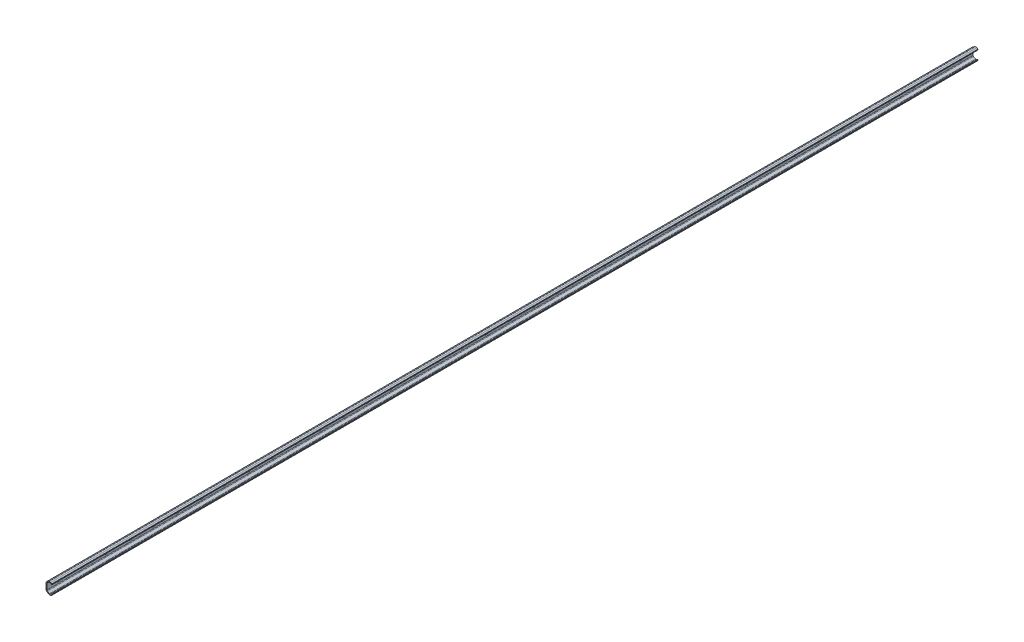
SolidWorks part; units mm, degrees
ref_plane "Front Plane" through (0, 0, 0) normal (0, 0, 1) x (1, 0, 0)
ref_plane "Top Plane" through (0, 0, 0) normal (0, 1, 0) x (1, 0, 0)
ref_plane "Right Plane" through (0, 0, 0) normal (1, 0, 0) x (0, 0, -1)
sketch "Sketch1" plane through (0, 0, 0) normal (0, 0, 1) x (1, 0, 0)
  line L0 (19.4996, 13.4748) -> (20, 14.3415)
  line L1 (20, 14.3415) -> (20, 16.65)
  line L2 (20, 16.65) -> (16.0762, 18.9154)
  line L3 (10, 18.9601) -> (3, 14.9186)
  line L4 (0, 9.7225) -> (0, 0)
  line L5 (0, 0) -> (0, -9.7225)
  line L6 (3, -14.9186) -> (10, -18.9601)
  line L7 (16.0762, -18.9154) -> (20, -16.65)
  line L8 (20, -16.65) -> (20, -14.3415)
  line L9 (20, -14.3415) -> (19.4996, -13.4748)
  line L10 (19.4996, -13.4748) -> (14.5538, -16.3303)
  line L11 (11.5, -16.3621) -> (4.5, -12.3206)
  line L12 (3, -9.7225) -> (3, 9.7225)
  line L13 (4.5, 12.3206) -> (11.5, 16.3621)
  line L14 (14.5538, 16.3303) -> (19.4996, 13.4748)
  arc A0 (16.0762, 18.9154) -> (10, 18.9601) centre (12.9987, 13.585) ccw
  arc A1 (3, 14.9186) -> (0, 9.7225) centre (6, 9.7225) ccw
  arc A2 (0, -9.7225) -> (3, -14.9186) centre (6, -9.7225) ccw
  arc A3 (10, -18.9601) -> (16.0762, -18.9154) centre (13, -13.764) ccw
  arc A4 (14.5538, -16.3303) -> (11.5, -16.3621) centre (12.9987, -13.6368) cw
  arc A5 (4.5, -12.3206) -> (3, -9.7225) centre (6, -9.7225) cw
  arc A6 (3, 9.7225) -> (4.5, 12.3206) centre (6, 9.7225) cw
  arc A7 (11.5, 16.3621) -> (14.5538, 16.3303) centre (13, 13.764) cw
  point P10 (20, -15.4957)
  dimension "D1" = 3
  dimension "D12" = 6.155
  dimension "D2" = 4.5
  dimension "D3" = 10
  dimension "D4" = 16.0762
  dimension "D5" = 9.7225
  dimension "D6" = 19.4996
  dimension "D7" = 20
  dimension "D8" = 13.4748
  dimension "D9" = 16.3621
  dimension "D10" = 16.3303
  dimension "D11" = 18.9154
  dimension "D13" = 20
extrude "Boss-Extrude1" add sketch "Sketch1" against normal blind 3120 contours L4 L5 A2 L6 A3 L7 L8 L9 L10 A4 L11 A5 L12 A6 L13 A7 L14 L0 L1 L2 A0 L3 A1
sketch "Sketch2" plane through (3, 0, 0) normal (1, 0, 0) x (0, 0, -1)
  line L0 (42, 0) -> (38, 0) construction
  line L1 (42, -4.5) -> (38, -4.5)
  line L2 (42, 4.5) -> (38, 4.5)
  arc A0 (42, -4.5) -> (42, 4.5) centre (42, 0) ccw
  arc A1 (38, 4.5) -> (38, -4.5) centre (38, 0) ccw
  point P2 (40, 0)
  point P8 (40, 4.5)
  dimension "D1" = 4
  dimension "D2" = 9
  dimension "D3" = 40
extrude "Cut-Extrude1" cut sketch "Sketch2" against normal through all
pattern_linear "LPattern1" count 39 spacing 80 along (0, 0, -1) of "Cut-Extrude1"
